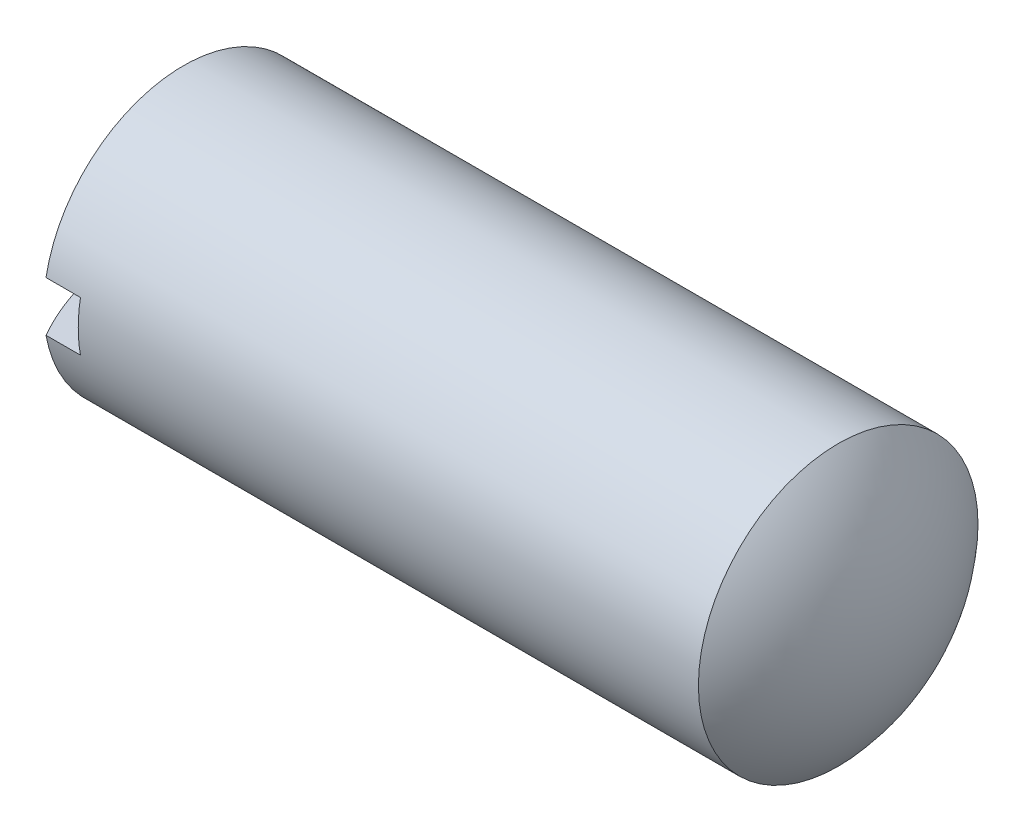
SolidWorks part; units mm, degrees
ref_plane "Plane1" through (0, 0, 0) normal (0, 0, 1) x (1, 0, 0)
ref_plane "Plane2" through (0, 0, 0) normal (0, 1, 0) x (1, 0, 0)
ref_plane "Plane3" through (0, 0, 0) normal (1, 0, 0) x (0, 0, -1)
sketch "BodySke" plane through (0, 0, 0) normal (0, 0, 1) x (1, 0, 0)
  line L0 (2.5522, -9.525) -> (47.1574, -9.525) construction
  line L1 (2.0066, 12.7) -> (2.0066, -9.525) construction
  line L2 (2.5522, 9.525) -> (47.1574, 9.525)
  line L4 (50.8, 0) -> (0, 0)
  line L5 (-12.7, 0) -> (88.9, 0) construction
  arc A0 (50.8, 0) -> (47.1574, 9.525) centre (36.5252, 0) ccw
  arc A1 (2.5522, 9.525) -> (0, 0) centre (19.05, 0) ccw
  dimension "Oval_radius" = 14.2748
  dimension "Crown_radius" = 19.05
  dimension "Length" = 50.8
  dimension "Diameter" = 19.05
  dimension "Advance" = 2.0066
revolve "BaseBody" add sketch "BodySke" angle 360 about L5
sketch "Sketch2" plane through (0, 0, 0) normal (1, 0, 0) x (0, 0, -1)
  line L1 (9.525, -1.7018) -> (-9.525, -1.7018)
  line L2 (9.525, -1.7018) -> (9.525, 1.7018)
  line L3 (9.525, 1.7018) -> (-9.525, 1.7018)
  line L4 (-9.525, -1.7018) -> (-9.525, 1.7018)
  dimension "D1" = 19.05
  dimension "D2" = 1.7018
  dimension "Slot_width" = 3.4036
  dimension "D3" = 9.525
extrude "Slot" cut sketch "Sketch2" along normal blind 4.9022
sketch "ThdSchSke" plane through (0, 0, 0) normal (0, 0, 1) x (1, 0, 0)
  line L0 (2.5522, -8.0124) -> (1.4931, -9.525)
  line L1 (2.5522, -8.0124) -> (3.6113, -9.525)
  line L2 (3.6113, -9.525) -> (3.6113, -11.9063)
  line L3 (-3.175, 0) -> (5.1513, 0) construction
  line L4 (2.5522, -9.525) -> (2.5522, -1.7018) construction
  line L5 (3.6113, -11.9063) -> (1.4931, -11.9063)
  line L6 (1.4931, -11.9063) -> (1.4931, -9.525)
  dimension "Thread_minor" = 16.0249
  dimension "Diameter" = 19.05
  dimension "SideAngle" = 55
  dimension "VeeAngle" = 70
  dimension "Overcut" = 23.8125
revolve "ThreadSchematic" [suppressed] cut sketch "ThdSchSke" angle 360 about L3
pattern_linear "ThdSchPat" [suppressed]
equation "\"D1@Sketch2\" = \"Diameter@BodySke\""
equation "\"D3@Sketch2\" = \"D1@Sketch2\" / 2"
equation "\"D2@Sketch2\" = \"Slot_width@Sketch2\" / 2"
equation "\"Thread_minor@ThdSchSke\" = \"Thread_minor@ThreadCosmetic\""
equation "\"Diameter@ThdSchSke\" = \"Diameter@BodySke\""
equation "\"Overcut@ThdSchSke\" = \"Diameter@BodySke\" * 1.25"
equation "\"Num_threads@ThdSchPat\" = int ( ( \"Length@BodySke\" - ( \"Crown_radius@BodySke\" - sqr ( ( \"Crown_radius@BodySke\" * \"Crown_radius@BodySke\" ) - ( ( \"Diameter@BodySke\" * 0.5 ) * ( \"Diameter@BodySke\" * 0.5 "
equation "\"Advance@ThdSchPat\" = ( \"Length@BodySke\" - ( \"Crown_radius@BodySke\" - sqr ( ( \"Crown_radius@BodySke\" * \"Crown_radius@BodySke\" ) - ( ( \"Diameter@BodySke\" * 0.5 ) * ( \"Diameter@BodySke\" * 0.5 ) ) ) ) - "
equation "' \"Num_threads@ThdSchPat\" = \"Num_threads@ThdSchPat\" - sgn( \"Num_threads@ThdSchPat\" - 1) '---chamfered tips only---"
